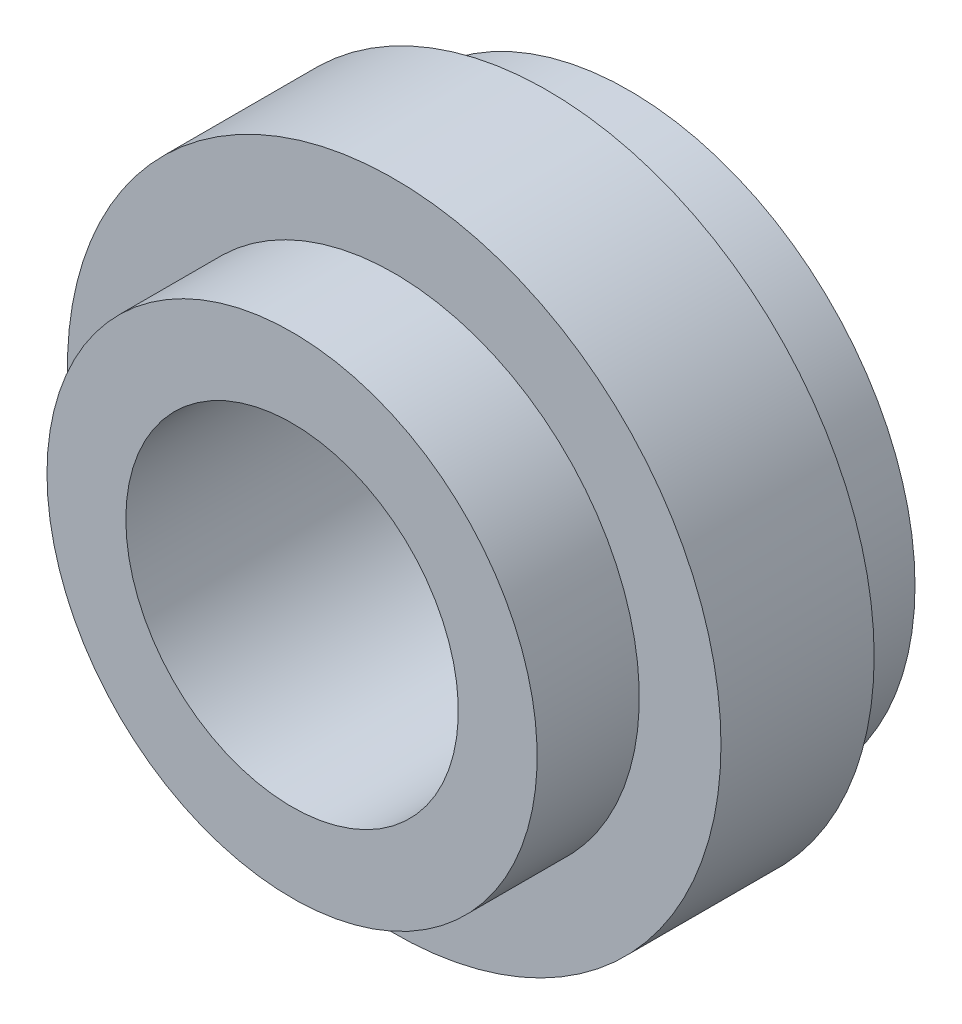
SolidWorks part; units mm, degrees
ref_plane "Front Plane" through (0, 0, 0) normal (0, 0, 1) x (1, 0, 0)
ref_plane "Top Plane" through (0, 0, 0) normal (0, 1, 0) x (1, 0, 0)
ref_plane "Right Plane" through (0, 0, 0) normal (1, 0, 0) x (0, 0, -1)
sketch "Sketch1" plane through (0, 0, 0) normal (0, 0, 1) x (1, 0, 0)
  circle A0 centre (0, 0) radius 6
  circle A1 centre (0, 0) radius 4.07
  dimension "D1" = 8.14
  dimension "D2" = 12
extrude "Extrude1" add sketch "Sketch1" along normal blind 2.5
sketch "Sketch2" plane through (0, 0, 0) normal (0, 0, -1) x (-1, 0, 0)
  circle A0 centre (0, 0) radius 8
  circle A1 centre (0, 0) radius 4.07 construction
  circle A2 centre (0, 0) radius 4.07
  dimension "D1" = 16
extrude "Extrude2" add sketch "Sketch2" along normal blind 5.75
sketch "Sketch3" plane through (0, 0, 0) normal (1, 0, 0) x (0, 0, -1)
  line L0 (0, 0) -> (10.2205, 0) construction
  line L1 (5.75, 8) -> (0, 8) construction
  line L2 (3.75, 8) -> (5.75, 8)
  line L3 (3.75, 8) -> (3.75, 7)
  line L4 (3.75, 7) -> (5.75, 7)
  line L5 (5.75, 8) -> (5.75, 7)
  line L6 (5.75, -8) -> (5.75, 8) construction
  dimension "D1" = 1
  dimension "D2" = 2
revolve "Cut-Revolve1" cut sketch "Sketch3" angle 360 about L0
